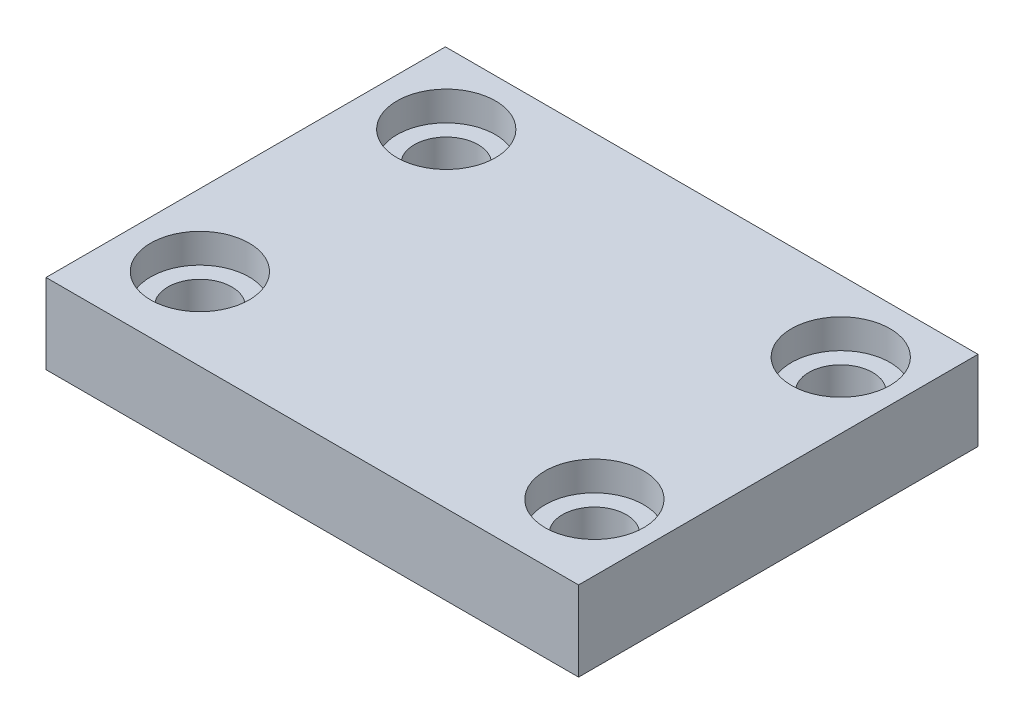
SolidWorks part; units mm, degrees
ref_plane "Front" through (0, 0, 0) normal (0, 0, 1) x (1, 0, 0)
ref_plane "Top" through (0, 0, 0) normal (0, 1, 0) x (1, 0, 0)
ref_plane "Right" through (0, 0, 0) normal (1, 0, 0) x (0, 0, -1)
sketch "Sketch1" plane through (0, 0, 0) normal (0, 1, 0) x (1, 0, 0)
  line L0 (50, -37.5) -> (-50, 37.5) construction
  line L1 (-50, 37.5) -> (50, 37.5)
  line L2 (-50, 37.5) -> (-50, -37.5)
  line L3 (-50, -37.5) -> (50, -37.5)
  line L4 (50, 37.5) -> (50, -37.5)
  dimension "D1" = 100
  dimension "D2" = 75
extrude "Extrude1" add sketch "Sketch1" along normal blind 15
hole_wizard "CBORE for M10 SBHCS1" positions "Sketch3" profile "Sketch2" counterbore size "M10" standard "Ansi Metric"
sketch "Sketch3" plane through (0, 15, 0) normal (0, 1, 0) x (-1, 0, 0)
  point P0 (36.5164, 22.0884)
  point P1 (36.5164, -24.1708)
  point P2 (-37.5576, -24.1708)
  point P3 (-37.5576, 22.0884)
sketch "Sketch2" plane through (-36.5164, 15, 22.0884) normal (1, 0, 0) x (0, 0, 1)
  line L0 (0, 0) -> (0, 15)
  line L1 (0, 15) -> (6, 15)
  line L3 (6, 15) -> (6, 5.5)
  line L4 (6, 5.5) -> (9.25, 5.5)
  line L5 (9.25, 5.5) -> (9.25, 0)
  line L7 (9.25, 0) -> (0, 0)
  line L11 (0, -6.35) -> (0, 107.95) construction
  dimension "Thru Hole Dia." = 12
  dimension "Thru Hole Depth" = 15
  dimension "C'Bore Dia." = 18.5
  dimension "C'Bore Depth" = 5.5
